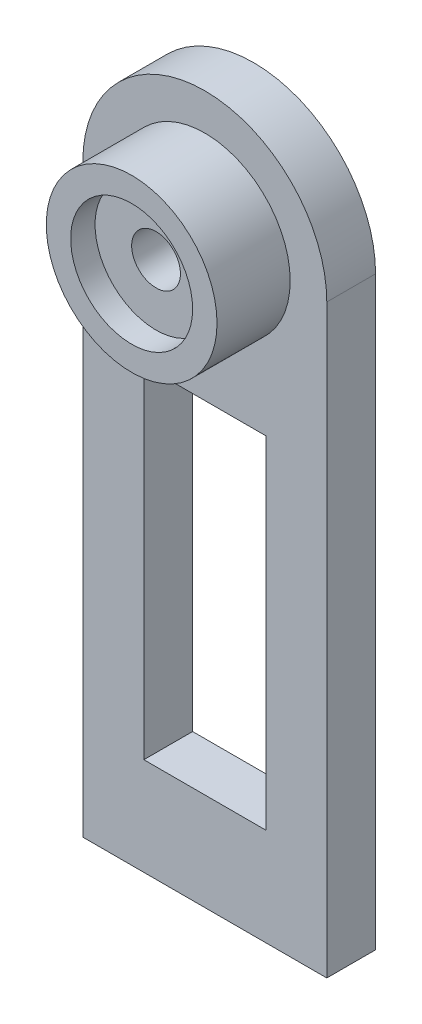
SolidWorks part; units mm, degrees
ref_plane "Front Plane" through (0, 0, 0) normal (0, 0, 1) x (1, 0, 0)
ref_plane "Top Plane" through (0, 0, 0) normal (0, 1, 0) x (1, 0, 0)
ref_plane "Right Plane" through (0, 0, 0) normal (1, 0, 0) x (0, 0, -1)
sketch "Sketch1" plane through (0, 0, 0) normal (0, 0, 1) x (1, 0, 0)
  line L0 (0, 0) -> (100, 0)
  line L1 (55, 0) -> (-55, 0) construction
  line L2 (100, 0) -> (100, 240)
  line L3 (0, -55) -> (0, 55) construction
  line L4 (0, 240) -> (0, 0)
  arc A0 (100, 240) -> (0, 240) centre (50, 240) ccw
  dimension "D1" = 100
  dimension "D2" = 240
extrude "Extrude1" add sketch "Sketch1" against normal blind 20
sketch "Sketch2" plane through (0, 0, 0) normal (0, 0, 1) x (1, 0, 0)
  circle A0 centre (50, 240) radius 35
  arc A1 (100, 240) -> (0, 240) centre (50, 240) ccw construction
  dimension "D1" = 70
extrude "Extrude2" add sketch "Sketch2" along normal blind 30
hole_wizard "CBORE for M5 Hex Head Bolt3" positions "3DSketch2" profile "Sketch4" counterbore size "M5" standard "Ansi Metric"
sketch3d "3DSketch2"
  line L0 (50, 240, 30) -> (50, 240, 0) construction
  circle A0 centre (50, 240, 30) radius 35 construction
  point P0 (50, 240, 30)
  point P9 (50, 240, 65)
sketch "Sketch4" plane through (50, 240, 30) normal (1, 0, 0) x (0, -1, 0)
  line L0 (0, 0) -> (0, 50)
  line L1 (0, 50) -> (10, 50)
  line L3 (10, 50) -> (10, 10)
  line L4 (10, 10) -> (25, 10)
  line L5 (25, 10) -> (25, 0)
  line L7 (25, 0) -> (0, 0)
  line L11 (0, -6.35) -> (0, 107.95) construction
  dimension "Thru Hole Dia." = 20
  dimension "Thru Hole Depth" = 50
  dimension "C'Bore Dia." = 50
  dimension "C'Bore Depth" = 10
sketch "Sketch5" plane through (0, 0, 0) normal (0, 0, 1) x (1, 0, 0)
  line L0 (0, 240) -> (0, 0) construction
  line L1 (25, 40) -> (75, 40)
  line L2 (25, 40) -> (25, 180)
  line L3 (25, 180) -> (75, 180)
  line L4 (75, 40) -> (75, 180)
  line L5 (0, 0) -> (100, 0) construction
  dimension "D1" = 25
  dimension "D2" = 50
  dimension "D3" = 40
  dimension "D4" = 140
extrude "Cut-Extrude1" cut sketch "Sketch5" against normal through all
